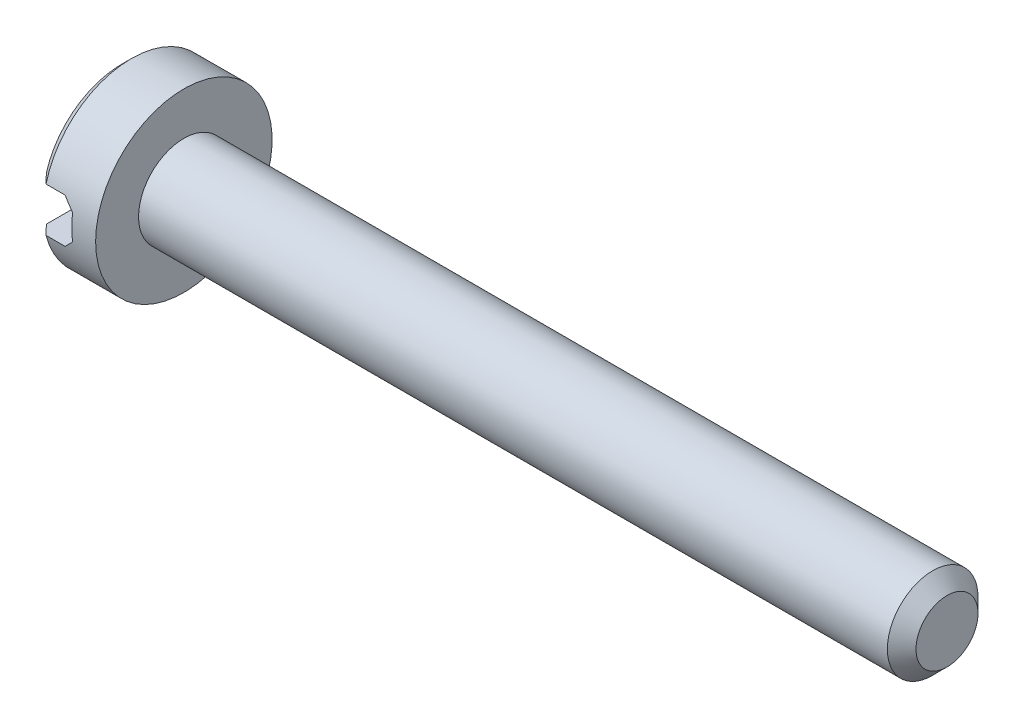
SolidWorks part; units mm, degrees
ref_plane "Face" through (0, 0, 0) normal (0, 0, 1) x (1, 0, 0)
ref_plane "Dessus" through (0, 0, 0) normal (0, 1, 0) x (1, 0, 0)
ref_plane "Droite" through (0, 0, 0) normal (1, 0, 0) x (0, 0, -1)
sketch "Esquisse1" plane through (0, 0, 0) normal (0, 0, 1) x (1, 0, 0)
  line L0 (0, 0) -> (0, 1.65)
  line L1 (0.2, 1.85) -> (1.3, 1.85)
  line L2 (1.3, 1.85) -> (1.3, 0)
  line L5 (0, 0) -> (7.6423, 0) construction
  line L7 (0, 1.65) -> (0.2, 1.85)
  line L8 (0, 0) -> (1.3, 0)
  point P1 (0, 1.85)
  dimension "D1" = 1.85
  dimension "D3" = 1.3
revolve "Révolution1" add sketch "Esquisse1" angle 360 about L5
sketch "Esquisse2" plane through (0, 0, 0) normal (0, 0, 1) x (1, 0, 0)
  line L0 (0, 1.65) -> (0, -1.65) construction
  line L1 (0, 0.4655) -> (0.6, 0.4655)
  line L2 (0, 0.4655) -> (0, -0.4655)
  line L3 (0, -0.4655) -> (0.6, -0.4655)
  line L4 (0.8, 0.2655) -> (0.8, -0.2655)
  line L5 (0.6, 0.4655) -> (0.8, 0.2655)
  line L6 (0.6, -0.4655) -> (0.8, -0.2655)
  point P1 (0.8, -0.4655)
  point P3 (0.8, 0.4655)
extrude "Enlèv. mat.-Extru.1" cut sketch "Esquisse2" against normal mid plane 10
sketch "Esquisse3" plane through (1.3, 0, 0) normal (1, 0, 0) x (0, 0, -1)
  circle A0 centre (0, 0) radius 0.95
extrude "Extrusion1" add sketch "Esquisse3" along normal blind 16
chamfer "Chanfrein1" distance 0.3 angle 45 1 edges at (17.3, 0, -0.95)
